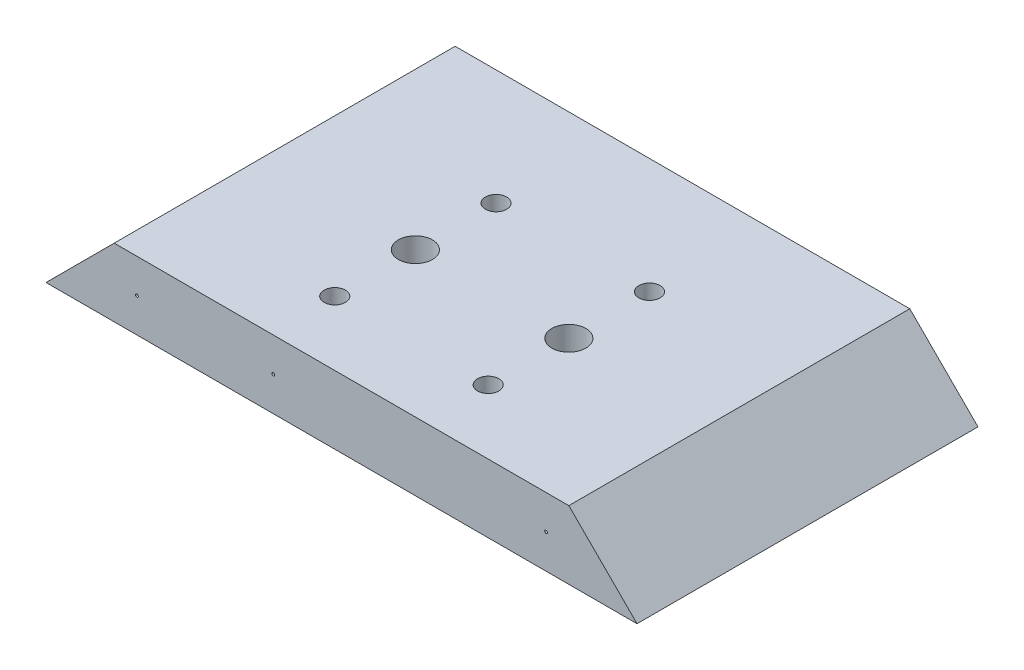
SolidWorks part; units mm, degrees
ref_plane "Front Plane" through (0, 0, 0) normal (0, 0, 1) x (1, 0, 0)
ref_plane "Top Plane" through (0, 0, 0) normal (0, 1, 0) x (1, 0, 0)
ref_plane "Right Plane" through (0, 0, 0) normal (1, 0, 0) x (0, 0, -1)
sketch "Sketch1" plane through (0, 0, 0) normal (0, 1, 0) x (1, 0, 0)
  line L1 (0, 0) -> (330.2, 0)
  line L2 (0, 0) -> (0, 190.5)
  line L3 (0, 190.5) -> (330.2, 190.5)
  line L4 (330.2, 0) -> (330.2, 190.5)
  dimension "D1" = 330.2
  dimension "D2" = 190.5
extrude "Boss-Extrude1" add sketch "Sketch1" along normal blind 38.1
hole_wizard "1/16 (0.0625) Diameter Hole7" positions "Sketch2" profile "Sketch4" hole size "1/16" standard "ANSI Inch"
sketch "Sketch2" plane through (0, 0, 0) normal (0, 0, 1) x (1, 0, 0)
  point P0 (50.8, 19.05)
  point P2 (279.4, 19.05)
  point P9 (127, 19.05)
  dimension "D1" = 50.8
  dimension "D2" = 127
  dimension "D3" = 19.05
  dimension "D4" = 50.8
sketch "Sketch4" plane through (50.8, 19.05, 0) normal (1, 0, 0) x (0, -1, 0)
  line L0 (0, 0) -> (0, 51.2769)
  line L1 (0, 51.2769) -> (0.7937, 50.8)
  line L2 (0.7937, 50.8) -> (0.7937, 0)
  line L5 (0.7937, 0) -> (0, 0)
  line L10 (0, 51.2769) -> (-0.7938, 50.8) construction
  line L11 (0, -6.35) -> (0, 107.95) construction
  dimension "Hole Dia." = 1.5875
  dimension "Hole Depth" = 50.8
  dimension "Drill Angle" = 118
hole_wizard "3/4 (0.75) Diameter Hole1" positions "Sketch12" profile "Sketch14" hole size "3/4" standard "ANSI Inch"
sketch "Sketch12" plane through (0, 0, 0) normal (0, -1, 0) x (-1, 0, 0)
  line L0 (0, 0) -> (-330.2, 0) construction
  point P0 (-211.1375, 80.9625)
  point P13 (-125.4125, 80.9625)
  dimension "D1" = 119.0625
  dimension "D2" = 80.9625
  dimension "D3" = 204.7875
  dimension "D4" = 125.4125
sketch "Sketch14" plane through (211.1375, 0, -80.9625) normal (1, 0, 0) x (0, 0, -1)
  line L0 (0, 0) -> (0, 38.1)
  line L1 (0, 38.1) -> (9.525, 38.1)
  line L2 (9.525, 38.1) -> (9.525, 0)
  line L5 (9.525, 0) -> (0, 0)
  line L11 (0, -6.35) -> (0, 107.95) construction
  dimension "Thru Hole Dia." = 19.05
  dimension "Thru Hole Depth" = 38.1
hole_wizard "15/32 (0.46875) Diameter Hole1" positions "Sketch21" profile "Sketch22" hole size "15/32" standard "ANSI Inch"
sketch "Sketch21" plane through (0, 38.1, 0) normal (0, 1, 0) x (1, 0, 0)
  point P0 (125.4125, 35.9172)
  point P2 (125.4125, 126.0078)
  point P19 (211.1375, 126.0078)
  point P21 (211.1375, 35.9172)
  dimension "D1" = 119.0625
  dimension "D4" = 35.9172
  dimension "D5" = 90.0906
  dimension "D6" = 204.7875
sketch "Sketch22" plane through (125.4125, 38.1, -35.9172) normal (1, 0, 0) x (0, 0, 1)
  line L0 (0, 0) -> (0, 38.1)
  line L1 (0, 38.1) -> (5.9531, 38.1)
  line L2 (5.9531, 38.1) -> (5.9531, 0)
  line L5 (5.9531, 0) -> (0, 0)
  line L11 (0, -6.35) -> (0, 107.95) construction
  dimension "Thru Hole Dia." = 11.9062
  dimension "Thru Hole Depth" = 38.1
chamfer "Chamfer1" distance 38.1 angle 45 2 edges at (0, 38.1, -95.25) (330.2, 38.1, -95.25)
